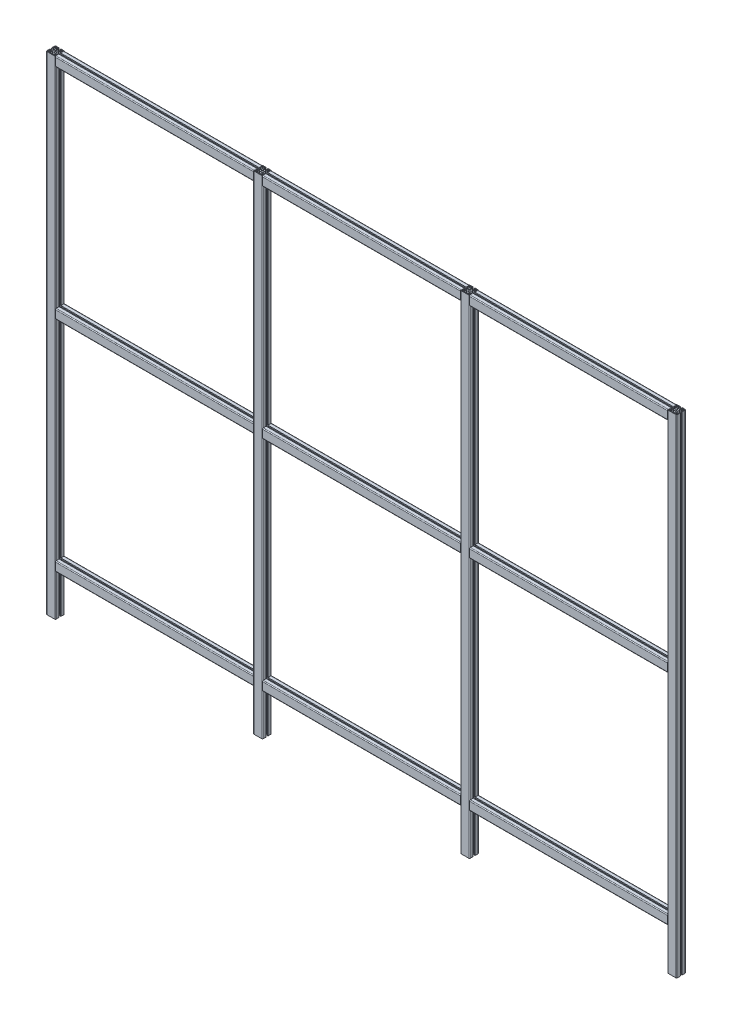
SolidWorks part; units mm, degrees
ref_plane "Top (Z)" through (0, 0, 0) normal (0, 0, 1) x (1, 0, 0)
ref_plane "Side (Y)" through (0, 0, 0) normal (0, 1, 0) x (1, 0, 0)
ref_plane "Front (X)" through (0, 0, 0) normal (1, 0, 0) x (0, 0, -1)
sketch3d "3DSketch1"
  line L0 (-1350, 0, 0) -> (-450, 0, 0)
  line L1 (-1350, 0, 0) -> (-1350, -2100, 0)
  line L2 (-450, 0, 0) -> (-450, -2100, 0)
  line L3 (450, 0, 0) -> (450, -2100, 0)
  line L4 (1350, 0, 0) -> (1350, -2100, 0)
  line L5 (-1350, -1900, 0) -> (-450, -1900, 0)
  line L6 (-450, -1900, 0) -> (450, -1900, 0)
  line L7 (450, -1900, 0) -> (1350, -1900, 0)
  line L8 (-1350, -950, 0) -> (-450, -950, 0)
  line L9 (-450, -950, 0) -> (450, -950, 0)
  line L10 (450, -950, 0) -> (1350, -950, 0)
  line L11 (-450, 0, 0) -> (450, 0, 0)
  line L12 (1350, 0, 0) -> (450, 0, 0)
  point P2 (-432.8302, 70.4206, -35.4463)
  point P18 (0, 0, 0)
  dimension "D1" = 900
  dimension "D4" = 2100
  dimension "D2" = 900
  dimension "D3" = 900
  dimension "D5" = 200
  dimension "D6" = 950
other "Closed profiles 40 light SP5510N PROFILE 40X40 3N LET(1)"
ref_plane "Plane1" through (-1350, 0, 0) normal (0, -1, 0) x (0, 0, -1)
sketch "Sketch13" plane through (-1350, 0, 0) normal (0, -1, 0) x (0, 0, -1)
  line L8 (17.1, -11.7) -> (12.7, -11.7)
  line L9 (18.1, -15.6) -> (18.1, -12.7)
  line L10 (12.7, -18.1) -> (15.6, -18.1)
  line L11 (11.7, -12.7) -> (11.7, -17.1)
  line L16 (-11.7, -17.1) -> (-11.7, -12.7)
  line L17 (-15.6, -18.1) -> (-12.7, -18.1)
  line L18 (-18.1, -12.7) -> (-18.1, -15.6)
  line L19 (-12.7, -11.7) -> (-17.1, -11.7)
  line L24 (-17.1, 11.7) -> (-12.7, 11.7)
  line L25 (-18.1, 15.6) -> (-18.1, 12.7)
  line L26 (-12.7, 18.1) -> (-15.6, 18.1)
  line L27 (-11.7, 12.7) -> (-11.7, 17.1)
  line L32 (11.7, 17.1) -> (11.7, 12.7)
  line L33 (15.6, 18.1) -> (12.7, 18.1)
  line L34 (18.1, 12.7) -> (18.1, 15.6)
  line L35 (12.7, 11.7) -> (17.1, 11.7)
  line L92 (15.5, 4.1) -> (20, 4.1)
  line L93 (20, 4.1) -> (20, 16.5)
  line L94 (16.5, 20) -> (4.1, 20)
  line L95 (4.1, 20) -> (4.1, 15.5)
  line L96 (4.1, 15.5) -> (6, 15.5)
  line L97 (6, 15.5) -> (6, 18)
  line L98 (6, 18) -> (10, 18)
  line L99 (10, 18) -> (10, 12.121)
  line L100 (10, 12.121) -> (5.479, 7.6)
  line L101 (5.479, 7.6) -> (-5.479, 7.6)
  line L102 (-5.479, 7.6) -> (-10, 12.121)
  line L103 (-10, 12.121) -> (-10, 18)
  line L104 (-10, 18) -> (-6, 18)
  line L105 (-6, 18) -> (-6, 15.5)
  line L106 (-6, 15.5) -> (-4.1, 15.5)
  line L107 (-4.1, 15.5) -> (-4.1, 20)
  line L108 (-4.1, 20) -> (-16.5, 20)
  line L109 (-20, 16.5) -> (-20, -16.5)
  line L110 (-16.5, -20) -> (-4.1, -20)
  line L111 (-4.1, -20) -> (-4.1, -15.5)
  line L112 (-4.1, -15.5) -> (-6, -15.5)
  line L113 (-6, -15.5) -> (-6, -18)
  line L114 (-6, -18) -> (-10, -18)
  line L115 (-10, -18) -> (-10, -12.121)
  line L116 (-10, -12.121) -> (-5.479, -7.6)
  line L117 (-5.479, -7.6) -> (5.479, -7.6)
  line L118 (5.479, -7.6) -> (10, -12.121)
  line L119 (10, -12.121) -> (10, -18)
  line L120 (10, -18) -> (6, -18)
  line L121 (6, -18) -> (6, -15.5)
  line L122 (6, -15.5) -> (4.1, -15.5)
  line L123 (4.1, -15.5) -> (4.1, -20)
  line L124 (4.1, -20) -> (16.5, -20)
  line L125 (20, -16.5) -> (20, -4.1)
  line L126 (20, -4.1) -> (15.5, -4.1)
  line L127 (15.5, -4.1) -> (15.5, -6)
  line L128 (15.5, -6) -> (18, -6)
  line L129 (18, -6) -> (18, -10)
  line L130 (18, -10) -> (12.121, -10)
  line L131 (12.121, -10) -> (7.6, -5.479)
  line L132 (7.6, -5.479) -> (7.6, 5.479)
  line L133 (7.6, 5.479) -> (12.121, 10)
  line L134 (12.121, 10) -> (18, 10)
  line L135 (18, 10) -> (18, 6)
  line L136 (18, 6) -> (15.5, 6)
  line L137 (15.5, 6) -> (15.5, 4.1)
  line L152 (-18, -4.1) -> (-15.5, -4.1)
  line L153 (-18, 4.1) -> (-18, -4.1)
  line L154 (-15.5, 4.1) -> (-18, 4.1)
  line L155 (-15.5, 6) -> (-15.5, 4.1)
  line L156 (-18, 6) -> (-15.5, 6)
  line L157 (-18, 10) -> (-18, 6)
  line L158 (-12.121, 10) -> (-18, 10)
  line L159 (-7.6, 5.479) -> (-12.121, 10)
  line L160 (-7.6, -5.479) -> (-7.6, 5.479)
  line L161 (-12.121, -10) -> (-7.6, -5.479)
  line L162 (-18, -10) -> (-12.121, -10)
  line L163 (-18, -6) -> (-18, -10)
  line L164 (-15.5, -6) -> (-18, -6)
  line L165 (-15.5, -4.1) -> (-15.5, -6)
  circle A2 centre (0, 0) radius 3.4
  arc A8 (20, 16.5) -> (16.5, 20) centre (16.5, 16.5) ccw
  arc A9 (-16.5, 20) -> (-20, 16.5) centre (-16.5, 16.5) ccw
  arc A10 (-20, -16.5) -> (-16.5, -20) centre (-16.5, -16.5) ccw
  arc A11 (16.5, -20) -> (20, -16.5) centre (16.5, -16.5) ccw
  arc A16 (18.1, -12.7) -> (17.1, -11.7) centre (17.1, -12.7) ccw
  arc A17 (15.6, -18.1) -> (18.1, -15.6) centre (15.6, -15.6) ccw
  arc A18 (11.7, -17.1) -> (12.7, -18.1) centre (12.7, -17.1) ccw
  arc A19 (12.7, -11.7) -> (11.7, -12.7) centre (12.7, -12.7) ccw
  arc A24 (-12.7, -18.1) -> (-11.7, -17.1) centre (-12.7, -17.1) ccw
  arc A25 (-18.1, -15.6) -> (-15.6, -18.1) centre (-15.6, -15.6) ccw
  arc A26 (-17.1, -11.7) -> (-18.1, -12.7) centre (-17.1, -12.7) ccw
  arc A27 (-11.7, -12.7) -> (-12.7, -11.7) centre (-12.7, -12.7) ccw
  arc A32 (-18.1, 12.7) -> (-17.1, 11.7) centre (-17.1, 12.7) ccw
  arc A33 (-15.6, 18.1) -> (-18.1, 15.6) centre (-15.6, 15.6) ccw
  arc A34 (-11.7, 17.1) -> (-12.7, 18.1) centre (-12.7, 17.1) ccw
  arc A35 (-12.7, 11.7) -> (-11.7, 12.7) centre (-12.7, 12.7) ccw
  arc A40 (12.7, 18.1) -> (11.7, 17.1) centre (12.7, 17.1) ccw
  arc A41 (18.1, 15.6) -> (15.6, 18.1) centre (15.6, 15.6) ccw
  arc A42 (17.1, 11.7) -> (18.1, 12.7) centre (17.1, 12.7) ccw
  arc A43 (11.7, 12.7) -> (12.7, 11.7) centre (12.7, 12.7) ccw
  point P100 (0, 20)
  point P107 (20, 20)
  point P120 (-20, 20)
  point P121 (20, 0)
  point P122 (0, 0)
  point P123 (20, -20)
  point P124 (0, -20)
  point P125 (-20, -20)
  point P126 (-20, 0)
  point P127 (0, 0)
other "Trim/Extend1"
